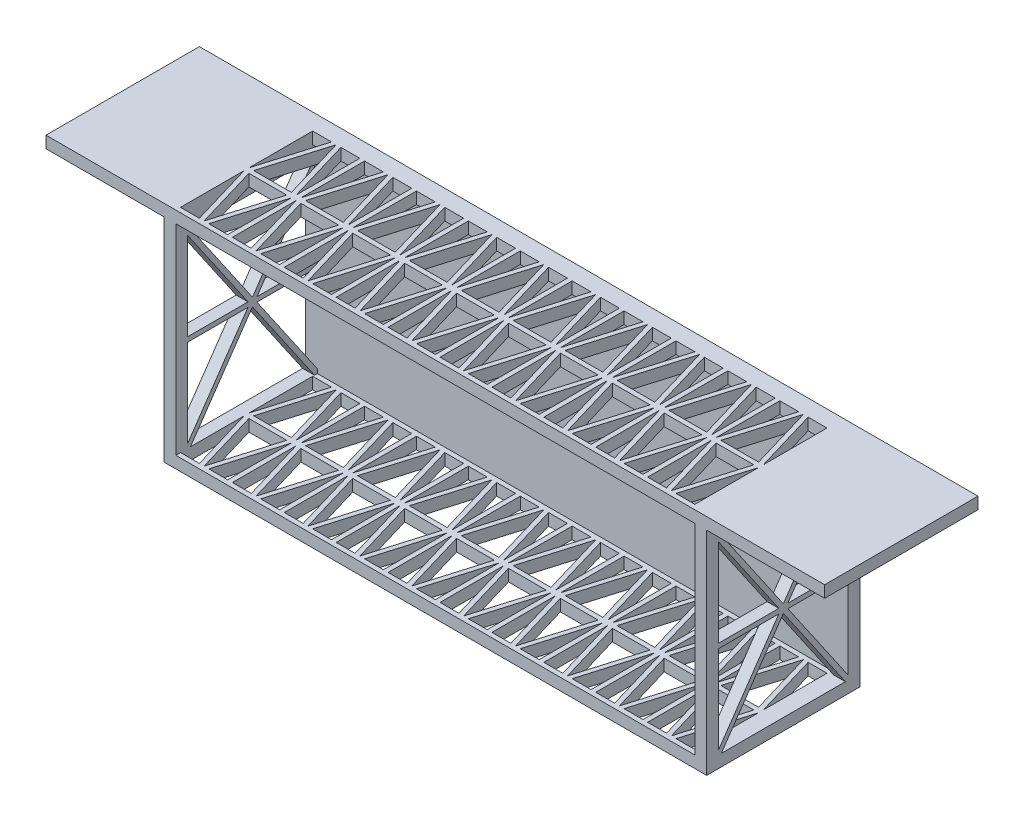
SolidWorks part; units mm, degrees
ref_plane "Alzado" through (0, 0, 0) normal (0, 0, 1) x (1, 0, 0)
ref_plane "Planta" through (0, 0, 0) normal (0, 1, 0) x (1, 0, 0)
ref_plane "Vista lateral" through (0, 0, 0) normal (1, 0, 0) x (0, 0, -1)
sketch "Croquis1" plane through (0, 0, 0) normal (0, 0, 1) x (1, 0, 0)
  line L1 (-110, -42.5) -> (110, -42.5)
  line L2 (-110, -42.5) -> (-110, 42.5)
  line L3 (-110, 42.5) -> (110, 42.5)
  line L4 (110, -42.5) -> (110, 42.5)
  line L5 (-110, -42.5) -> (110, 42.5) construction
  line L6 (-110, 42.5) -> (110, -42.5) construction
  point P0 (0, 0)
  dimension "D1" = 220
  dimension "D2" = 85
extrude "Saliente-Extruir1" add sketch "Croquis1" along normal blind 60
shell "Vaciado1" thickness 5
sketch "Croquis2" plane through (115, 0, 0) normal (1, 0, 0) x (0, 0, -1)
  line L0 (-60, 42.5) -> (5, 42.5)
  line L1 (-60, -47.5) -> (-60, 47.5) construction
  line L2 (5, -47.5) -> (5, 47.5) construction
  line L3 (-60, 47.5) -> (5, 47.5) construction
  line L4 (-60, 42.5) -> (-60, 47.5)
  line L5 (-60, 47.5) -> (5, 47.5)
  line L6 (5, 47.5) -> (5, 42.5)
  dimension "D1" = 5
extrude "Saliente-Extruir2" add sketch "Croquis2" along normal blind 50
sketch "Croquis3" plane through (0, -47.5, 0) normal (0, -1, 0) x (-1, 0, 0)
  line L0 (0, -60) -> (0, 5) construction
  line L1 (115, -60) -> (-115, -60) construction
  line L2 (115, 5) -> (-115, 5) construction
pattern_linear "MatrizL1" count 2 spacing 280 along (-1, 0, 0) of "Saliente-Extruir2"
sketch "Croquis9" plane through (0, -47.5, 0) normal (0, -1, 0) x (1, 0, 0)
  line L0 (-115, 60) -> (-110, 60) construction
  line L1 (-100, 2) -> (-108, 29)
  line L2 (-115, 60) -> (115, 60) construction
  line L3 (-110, 60) -> (-110, 58) construction
  line L4 (-110, 58) -> (-102, 58)
  line L5 (-110, 58) -> (-110, 31)
  line L6 (-110, 31) -> (-102, 58)
  line L7 (-102, 58) -> (-100, 58) construction
  line L8 (-110, 31) -> (-108, 31) construction
  line L9 (-100, 58) -> (-108, 31)
  line L10 (-100, 58) -> (-100, 31) construction
  line L11 (-108, 31) -> (-92, 31)
  line L12 (-100, 58) -> (-92, 31)
  line L13 (-90, 58) -> (-90, 31)
  line L14 (-90, 58) -> (-98, 58)
  line L15 (-90, 31) -> (-98, 58)
  line L16 (-110, 31) -> (-110, 30) construction
  line L17 (-100, 2) -> (-92, 29)
  line L18 (-110, 30) -> (-81.0426, 30) construction
  line L19 (-108, 29) -> (-92, 29)
  line L20 (-90, 2) -> (-98, 2)
  line L21 (-90, 58) -> (-89, 58) construction
  line L22 (-89, 58) -> (-89, 54.2589) construction
  line L23 (-90, 29) -> (-98, 2)
  line L24 (-90, 2) -> (-90, 29)
  line L25 (-110, 2) -> (-110, 29)
  line L26 (-110, 2) -> (-102, 2)
  line L27 (-110, 29) -> (-102, 2)
extrude "Cortar-Extruir8" cut sketch "Croquis9" against normal blind 144
pattern_linear "MatrizL9" count 10 spacing 22 along (1, 0, 0) of "Cortar-Extruir8"
sketch "Croquis12" plane through (115, 0, 0) normal (1, 0, 0) x (0, 0, -1)
  line L1 (-60, 42.5) -> (5, 42.5)
  line L2 (-60, 42.5) -> (-60, -47.5)
  line L3 (-60, -47.5) -> (5, -47.5)
  line L4 (5, 42.5) -> (5, -47.5)
ref_plane "Plano1" through (150, 0, 0) normal (1, 0, 0) x (0, 0, -1)
sketch "Croquis14" plane through (150, 0, 0) normal (1, 0, 0) x (0, 0, -1)
  line L0 (0, -1.5) -> (0, 35.7349)
  line L2 (5, 42.5) -> (5, -47.5) construction
  line L3 (-60, -47.5) -> (5, -47.5) construction
  line L4 (-53.7865, -42.5) -> (-1.2135, -42.5)
  line L5 (-55, -40.7349) -> (-55, -3.5)
  line L6 (-53.7865, 37.5) -> (-1.2135, 37.5)
  line L7 (0, -40.7349) -> (0, -3.5)
  line L10 (-55, -3.5) -> (-29.401, -3.5)
  line L11 (-53.7865, -42.5) -> (-27.5, -4.2651)
  line L12 (-55, 35.7349) -> (-29.401, -1.5)
  line L13 (-55, -1.5) -> (-29.401, -1.5)
  line L14 (-55, -40.7349) -> (-29.401, -3.5)
  line L15 (-53.7865, 37.5) -> (-27.5, -0.7349)
  line L22 (-55, -1.5) -> (-55, 35.7349)
  line L24 (-27.5, -4.2651) -> (-1.2135, -42.5)
  line L31 (-25.599, -1.5) -> (0, 35.7349)
  line L33 (-27.5, -0.7349) -> (-1.2135, 37.5)
  line L36 (-25.599, -3.5) -> (0, -3.5)
  line L37 (-25.599, -3.5) -> (0, -40.7349)
  line L38 (-25.599, -1.5) -> (0, -1.5)
  point P6 (-27.5, -2.5)
  dimension "D1" = 5
  dimension "D2" = 5
extrude "Cortar-Extruir9" cut sketch "Croquis14" against normal blind 316
